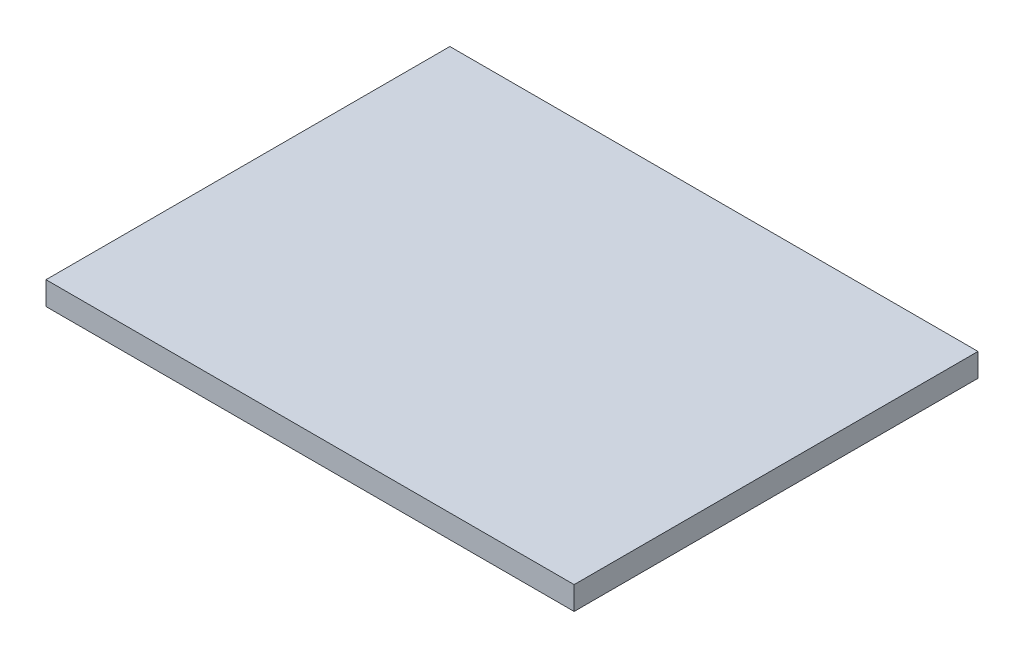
SolidWorks part; units mm, degrees
ref_plane "Front Plane" through (0, 0, 0) normal (0, 0, 1) x (1, 0, 0)
ref_plane "Top Plane" through (0, 0, 0) normal (0, 1, 0) x (1, 0, 0)
ref_plane "Right Plane" through (0, 0, 0) normal (1, 0, 0) x (0, 0, -1)
sketch "Sketch1" plane through (0, 0, 0) normal (0, 1, 0) x (1, 0, 0)
  line L1 (-53.975, -41.275) -> (53.975, -41.275)
  line L2 (-53.975, -41.275) -> (-53.975, 41.275)
  line L3 (-53.975, 41.275) -> (53.975, 41.275)
  line L4 (53.975, -41.275) -> (53.975, 41.275)
  line L5 (-53.975, -41.275) -> (53.975, 41.275) construction
  line L6 (-53.975, 41.275) -> (53.975, -41.275) construction
  point P0 (0, 0)
  dimension "D1" = 107.95
  dimension "D2" = 82.55
extrude "Boss-Extrude1" add sketch "Sketch1" along normal blind 4.7625
